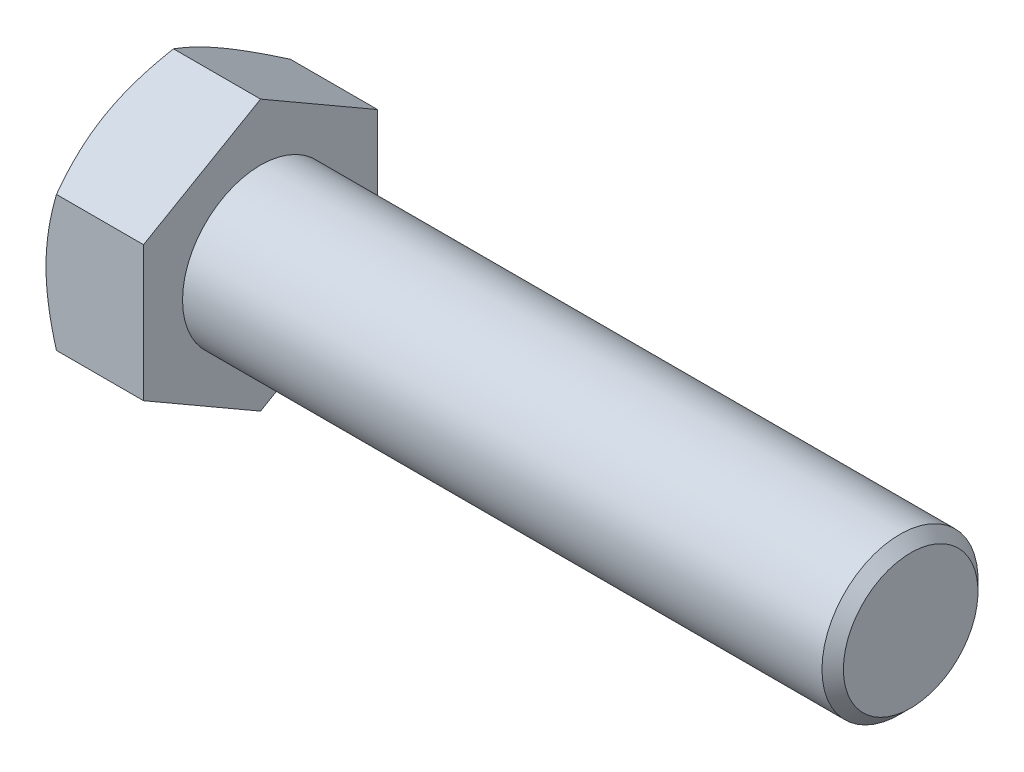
SolidWorks part; units mm, degrees
extrude "BaseHead" add sketch "Sketch1" along normal blind 15
sketch "Sketch1" plane through (0, 0, 0) normal (1, 0, 0) x (0, 0, -1)
  line L0 (18, 10.3923) -> (18, -10.3923)
  line L1 (-18, 10.3923) -> (-18, -10.3923)
  line L2 (18, -10.3923) -> (0, -20.7846)
  line L3 (0, -20.7846) -> (-18, -10.3923)
  line L4 (18, 10.3923) -> (0, 20.7846)
  line L5 (0, 20.7846) -> (-18, 10.3923)
ref_plane "Plane1" through (0, 0, 0) normal (0, 0, 1) x (1, 0, 0)
ref_plane "Plane2" through (0, 0, 0) normal (0, 1, 0) x (1, 0, 0)
ref_plane "Plane3" through (0, 0, 0) normal (1, 0, 0) x (0, 0, -1)
other "Configuration Table"
sketch "BodySke" plane through (0, 0, 0) normal (0, 0, 1) x (1, 0, 0)
  line L0 (0, 10.3923) -> (0, -10.3923) construction
  line L1 (0, 0) -> (115, 0)
  line L2 (0, 0) -> (0, 12)
  line L3 (0, 12) -> (113.352, 12)
  line L4 (115, 0) -> (115, 10.352)
  line L5 (15, 20.7846) -> (15, 10.3923) construction
  line L6 (115, 10.352) -> (113.352, 12)
  line L7 (0, 0) -> (96.52, 0) construction
  line L8 (115, -10.352) -> (113.352, -12) construction
  line L9 (0, -12) -> (113.352, -12) construction
  line L10 (18, 15.24) -> (18, -1.27) construction
  line L11 (61, 15.24) -> (61, -1.27) construction
  line L12 (15, 10.3923) -> (15, -10.3923) construction
revolve "BaseBody" add sketch "BodySke"
fillet "HeadFillet" [suppressed] radius 0.8
sketch "Sketch3" plane through (0, 0, 0) normal (0, 0, 1) x (1, 0, 0)
  line L0 (0, 18) -> (4.4944, 25.7846)
  line L1 (0, 20.7846) -> (0, 10.3923) construction
  line L2 (4.4944, 25.7846) -> (4.4944, 30.7846)
  line L3 (4.4944, 30.7846) -> (-10, 30.7846)
  line L4 (-10, 30.7846) -> (-10, 18)
  line L5 (-10, 18) -> (0, 18)
  line L6 (0, 0) -> (99.06, 0) construction
  line L7 (15, 20.7846) -> (0, 20.7846) construction
revolve "HeadChamfer" cut sketch "Sketch3" angle 360 about L6
sketch "ThdSchSke" plane through (0, 0, 0) normal (0, 0, 1) x (1, 0, 0)
  line L0 (61, -10.352) -> (59.8461, -12)
  line L1 (61, -10.352) -> (62.1539, -12)
  line L2 (62.1539, -12) -> (62.1539, -15)
  line L3 (-3.175, 0) -> (5.1513, 0) construction
  line L5 (62.1539, -15) -> (59.8461, -15)
  line L6 (59.8461, -15) -> (59.8461, -12)
revolve "ThreadSchematic" [suppressed] cut sketch "ThdSchSke" angle 360 about L3
pattern_linear "ThdSchPat" [suppressed]
equation "\"D3@Sketch1\" = \"Width_flats@Sketch1\" / 2"
equation "\"D4@Sketch1\" = \"D3@Sketch1\""
equation "\"D5@Sketch1\" = \"D4@Sketch1\""
equation "\"Thread_minor@ThreadCosmetic\" = \"Minor_dia@BodySke\""
equation "\"D1@Sketch3\" = \"Width_flats@Sketch1\" / 2"
equation "' \"D1@Sketch4\" = \"Width_flats@Sketch1\""
equation "\"Thread_length@ThreadCosmetic\" = ((sgn( (\"Length@BodySke\" - \"Advance@BodySke\" ) - \"Thread_nom@BodySke\" )-1)*( (\"Length@BodySke\" - \"Advance@BodySke\" ) - \"Thread_nom@BodySke\" ))/-2+ \"Thread_nom@BodySke\""
equation "\"Thread_minor@ThdSchSke\" = \"Minor_dia@BodySke\""
equation "\"Diameter@ThdSchSke\" = \"Diameter@BodySke\""
equation "\"Overcut@ThdSchSke\" = \"Diameter@BodySke\" * 1.25"
equation "\"Start@ThdSchSke\" = \"Head_ht@BaseHead\" + \"Length@BodySke\" - \"Thread_length@ThreadCosmetic\"  '---Non-countersunk---"
equation "\"Num_threads@ThdSchPat\" = int( \"Thread_length@ThreadCosmetic\" / \"Advance@BodySke\" + 0.999 )  + 1"
equation "\"Advance@ThdSchPat\" = \"Thread_length@ThreadCosmetic\" /  (\"Num_threads@ThdSchPat\" - 1) 'relax it"
equation "\"Num_threads@ThdSchPat\" = \"Num_threads@ThdSchPat\" - sgn( \"Num_threads@ThdSchPat\" - 1) '---chamfered tips only---"
